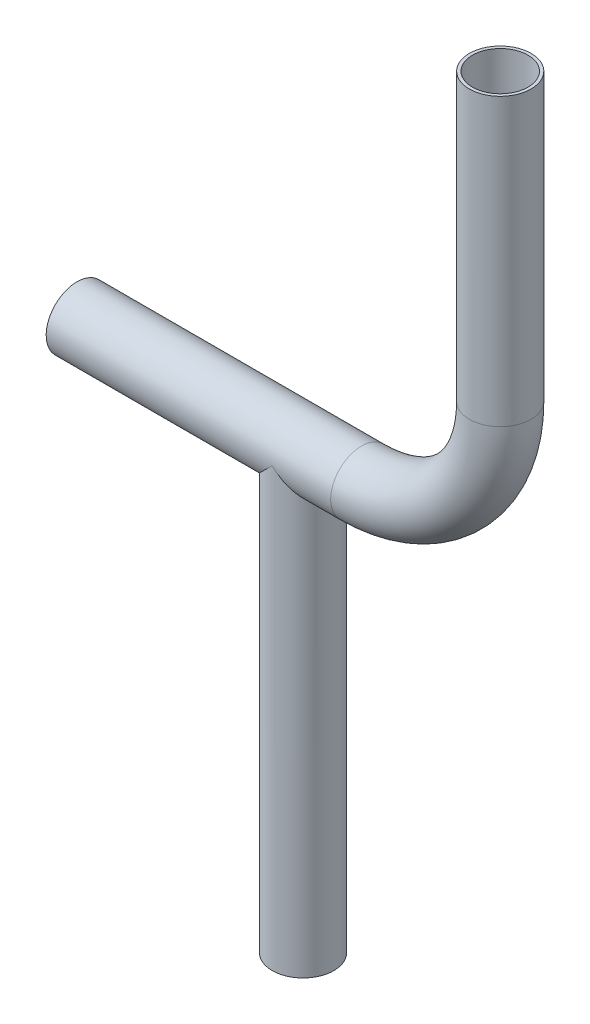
SolidWorks part; units mm, degrees
ref_plane "Plan de face" through (0, 0, 0) normal (0, 0, 1) x (1, 0, 0)
ref_plane "Plan de dessus" through (0, 0, 0) normal (0, 1, 0) x (1, 0, 0)
ref_plane "Plan de droite" through (0, 0, 0) normal (1, 0, 0) x (0, 0, -1)
sketch "Esquisse1" plane through (0, 0, 0) normal (0, 0, 1) x (1, 0, 0)
  line L0 (-428.9511, -38.6313) -> (-428.9511, 2136.3687) construction
  dimension "D1" = 2175
sketch "Esquisse2" plane through (0, 0, 0) normal (0, 0, 1) x (1, 0, 0)
  line L0 (-219.8134, 425.3663) -> (56.8805, 425.3663)
  line L1 (191.7864, 560.2722) -> (191.7864, 838.5394)
  arc A0 (56.8805, 425.3663) -> (191.7864, 560.2722) centre (56.8805, 560.2722) ccw
ref_plane "Plan1" through (-219.8134, 0, 0) normal (1, 0, 0) x (0, 0, -1)
sketch "Esquisse3" plane through (-219.8134, 0, 0) normal (1, 0, 0) x (0, 0, -1)
  circle A0 centre (0, 425.3663) radius 30
  circle A1 centre (0, 425.3663) radius 27
  dimension "D1" = 60
  dimension "D2" = 3
sweep "Balayage1" add profiles "Esquisse3" path "Esquisse2"
sketch "Esquisse4" plane through (0, 0, 0) normal (0, 1, 0) x (1, 0, 0)
  circle A0 centre (0, 0) radius 30
  circle A1 centre (0, 0) radius 27
  dimension "D1" = 60
  dimension "D2" = 3
extrude "Boss.-Extru.1" add sketch "Esquisse4" along normal up to surface (425.3663 mm away)
